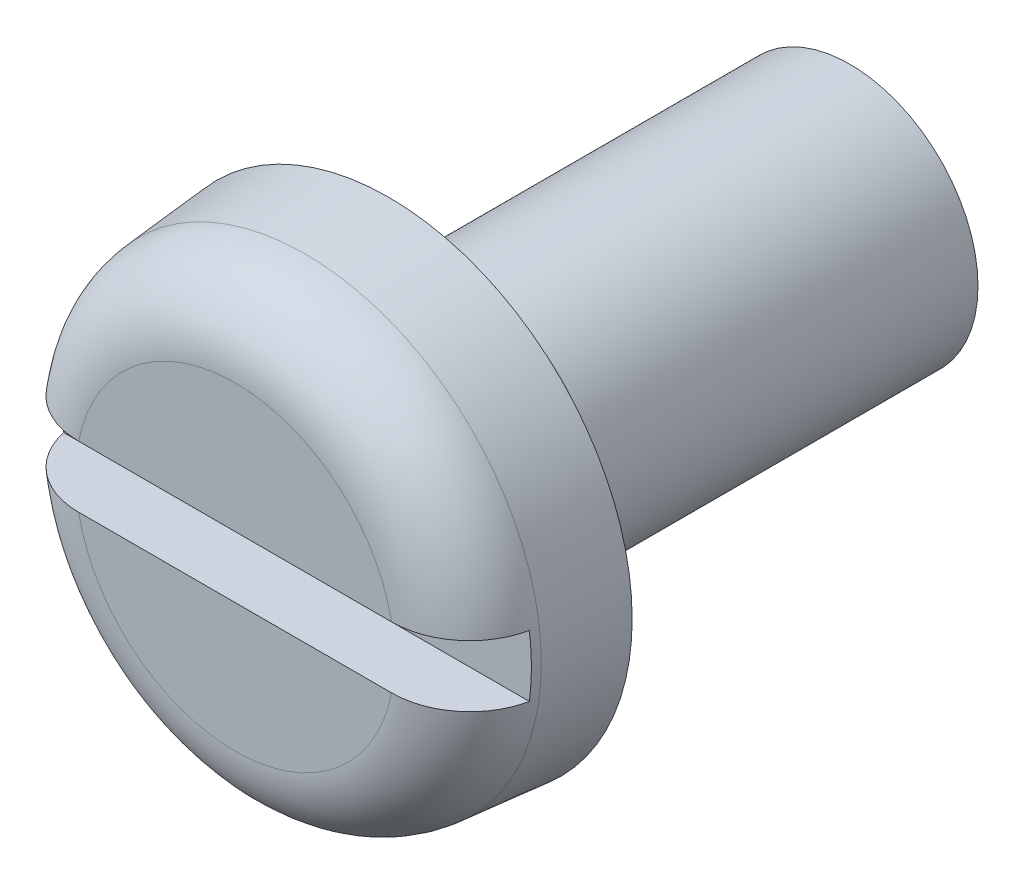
SolidWorks part; units mm, degrees
ref_plane "Face" through (0, 0, 0) normal (0, 0, 1) x (1, 0, 0)
ref_plane "Dessus" through (0, 0, 0) normal (0, 1, 0) x (1, 0, 0)
ref_plane "Droite" through (0, 0, 0) normal (1, 0, 0) x (0, 0, -1)
imported_body "Imported1"
sketch "Sketch1" plane through (0, 0, -6) normal (0, 0, -1) x (-1, 0, 0)
  circle A0 centre (0, 0) radius 2.5
extrude "Extrude1" add sketch "Sketch1" along normal blind 3
